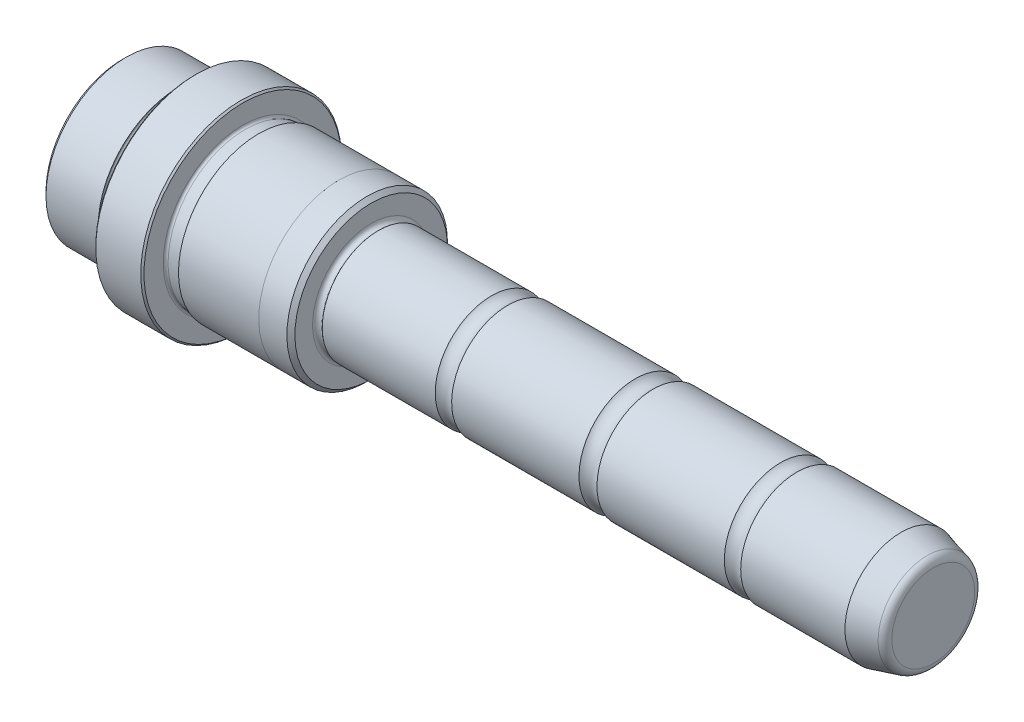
SolidWorks part; units mm, degrees
ref_plane "Front Plane" through (0, 0, 0) normal (0, 0, 1) x (1, 0, 0)
ref_plane "Top Plane" through (0, 0, 0) normal (0, 1, 0) x (1, 0, 0)
ref_plane "Right Plane" through (0, 0, 0) normal (1, 0, 0) x (0, 0, -1)
sketch "Sketch1" plane through (0, 0, 0) normal (0, 0, 1) x (1, 0, 0)
  line L0 (70, 5.9282) -> (66, 7)
  line L1 (66, 7) -> (0.9, 7)
  line L2 (0, 7.3) -> (0, 10)
  line L3 (0, 10) -> (-4, 10)
  line L4 (-14, 10.0001) -> (-14, 9.9)
  line L5 (-14.3, 9.6) -> (-15.7, 9.6)
  line L6 (-16, 9.9) -> (-16, 12.5)
  line L7 (-16, 12.5) -> (-22, 12.5)
  line L8 (-22, 12.5) -> (-22, 9.9)
  line L9 (-22.3, 9.6) -> (-23.7, 9.6)
  line L10 (-24, 9.9) -> (-24, 10)
  line L11 (-24, 10) -> (-31, 10)
  line L12 (-31, 10) -> (-31, 0)
  line L13 (70, 5.9282) -> (70, 0)
  line L14 (70, 0) -> (-70, 0) construction
  line L15 (70, 0) -> (-31, 0)
  line L16 (-4, 10.0001) -> (-14, 10.0001)
  line L17 (-4, 10.0001) -> (-4, 10)
  arc A0 (0, 7.3) -> (0.9, 7) centre (0.5, 7.3) ccw
  arc A1 (-22, 9.9) -> (-22.3, 9.6) centre (-22.3, 9.9) cw
  arc A2 (-23.7, 9.6) -> (-24, 9.9) centre (-23.7, 9.9) cw
  arc A3 (-15.7, 9.6) -> (-16, 9.9) centre (-15.7, 9.9) cw
  arc A4 (-14, 9.9) -> (-14.3, 9.6) centre (-14.3, 9.9) cw
  point P16 (0, 0)
  point P28 (-16, 9.6)
  point P31 (-14, 9.6)
  dimension "ShoulderRadii" = 1
  dimension "D5" = 0.3
  dimension "D1" = 15
  dimension "D2" = 0.4
  dimension "PinDia" = 14
  dimension "ChamferLeadIn" = 4
  dimension "ShoulderDia" = 20
  dimension "PinLengthN" = 70
  dimension "ShoulderLength" = 22
  dimension "D3" = 0.0001
  dimension "ShoulderGap" = 2
  dimension "D4" = 4
  dimension "T" = 6
  dimension "CollarLength" = 9
  dimension "HeadDia" = 25
  dimension "D8" = 0.2
revolve "Revolve1" add sketch "Sketch1" angle 360 about L14
sketch "Sketch2" plane through (0, 0, 0) normal (0, 0, 1) x (1, 0, 0)
  line L0 (70, -5.9282) -> (70, 5.9282) construction
  line L1 (145.9417, 6.6) -> (148.0583, 6.6) construction
  line L2 (66, 7) -> (0.9, 7) construction
  line L4 (50.9802, 7) -> (53.0198, 7)
  arc A0 (50.9802, 7) -> (53.0198, 7) centre (52, 8.1) ccw
  dimension "GrooveRadius" = 1.5
  dimension "D3" = 0.4
  dimension "AGroove" = 18
revolve "Groove A" cut sketch "Sketch2" angle 360 about axis through (70, 0, 0) along (1, 0, 0)
sketch "Sketch3" plane through (0, 0, 0) normal (0, 0, 1) x (1, 0, 0)
  line L0 (50.9802, 7) -> (0.9, 7) construction
  line L3 (32.882, 7) -> (35.118, 7)
  arc A0 (32.882, 7) -> (35.118, 7) centre (34, 8) ccw
  arc A1 (50.9802, 7) -> (53.0198, 7) centre (52, 8.1) ccw construction
  dimension "D1" = 0.5
  dimension "GroovePitch" = 18
revolve "Groove B" cut sketch "Sketch3" angle 360 about axis through (70, 0, 0) along (1, 0, 0)
sketch "Sketch4" plane through (0, 0, 0) normal (0, 0, 1) x (1, 0, 0)
  line L2 (32.882, 7) -> (0.9, 7) construction
  line L3 (14.9802, 7) -> (17.0198, 7)
  arc A0 (14.9802, 7) -> (17.0198, 7) centre (16, 8.1) ccw
  arc A3 (32.882, 7) -> (35.118, 7) centre (34, 8) ccw construction
  dimension "D1" = 0.4
revolve "Groove C" cut sketch "Sketch4" angle 360 about axis through (70, 0, 0) along (1, 0, 0)
sketch "Sketch5" plane through (0, 0, 0) normal (0, 0, 1) x (1, 0, 0)
  line L0 (-3.0198, 7) -> (-0.9802, 7)
  line L1 (14.9802, 7) -> (0.9, 7) construction
  arc A0 (-3.0198, 7) -> (-0.9802, 7) centre (-2, 8.1) ccw
  arc A3 (14.9802, 7) -> (17.0198, 7) centre (16, 8.1) ccw construction
  dimension "D1" = 0.4
revolve "Groove D" [suppressed] cut sketch "Sketch5" angle 360
fillet "Fillet1" radius 1 1 edges at (70, 5.9282, 0)
chamfer "Chamfer1" distance 0.2 angle 45 2 edges at (-22, 12.5, 0) (-16, 12.5, 0)
chamfer "Chamfer2" distance 0.5 angle 45 2 edges at (-31, 10, 0) (0, 10, 0)
